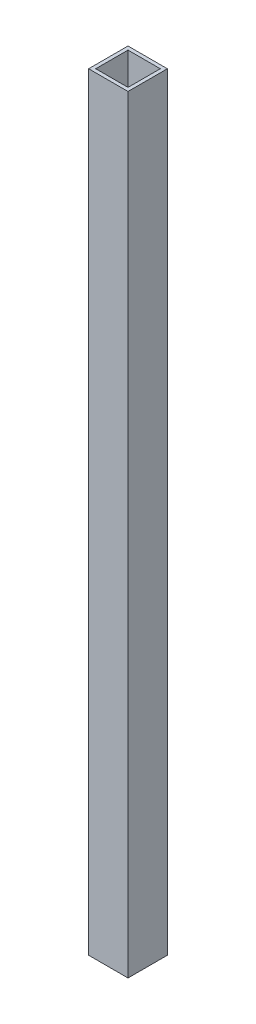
SolidWorks part; units mm, degrees
ref_plane "Plan de face" through (0, 0, 0) normal (0, 0, 1) x (1, 0, 0)
ref_plane "Plan de dessus" through (0, 0, 0) normal (0, 1, 0) x (1, 0, 0)
ref_plane "Plan de droite" through (0, 0, 0) normal (1, 0, 0) x (0, 0, -1)
sketch "Esquisse1" plane through (0, 0, 0) normal (0, 1, 0) x (1, 0, 0)
  line L1 (-5.5646, 5.5646) -> (5.5646, 5.5646)
  line L2 (-5.5646, 5.5646) -> (-5.5646, -5.5646)
  line L3 (-5.5646, -5.5646) -> (5.5646, -5.5646)
  line L4 (5.5646, 5.5646) -> (5.5646, -5.5646)
  line L5 (-5.5646, 5.5646) -> (5.5646, -5.5646) construction
  line L6 (-5.5646, -5.5646) -> (5.5646, 5.5646) construction
  line L7 (-4.5646, -4.5646) -> (4.5646, -4.5646)
  line L8 (-4.5646, -4.5646) -> (-4.5646, 4.5646)
  line L9 (-4.5646, 4.5646) -> (4.5646, 4.5646)
  line L10 (4.5646, -4.5646) -> (4.5646, 4.5646)
  line L11 (-4.5646, -4.5646) -> (4.5646, 4.5646) construction
  line L12 (-4.5646, 4.5646) -> (4.5646, -4.5646) construction
  point P0 (0, 0)
  point P5 (0, 0)
  dimension "D1" = 1
extrude "Boss.-Extru.1" add sketch "Esquisse1" along normal blind 217
